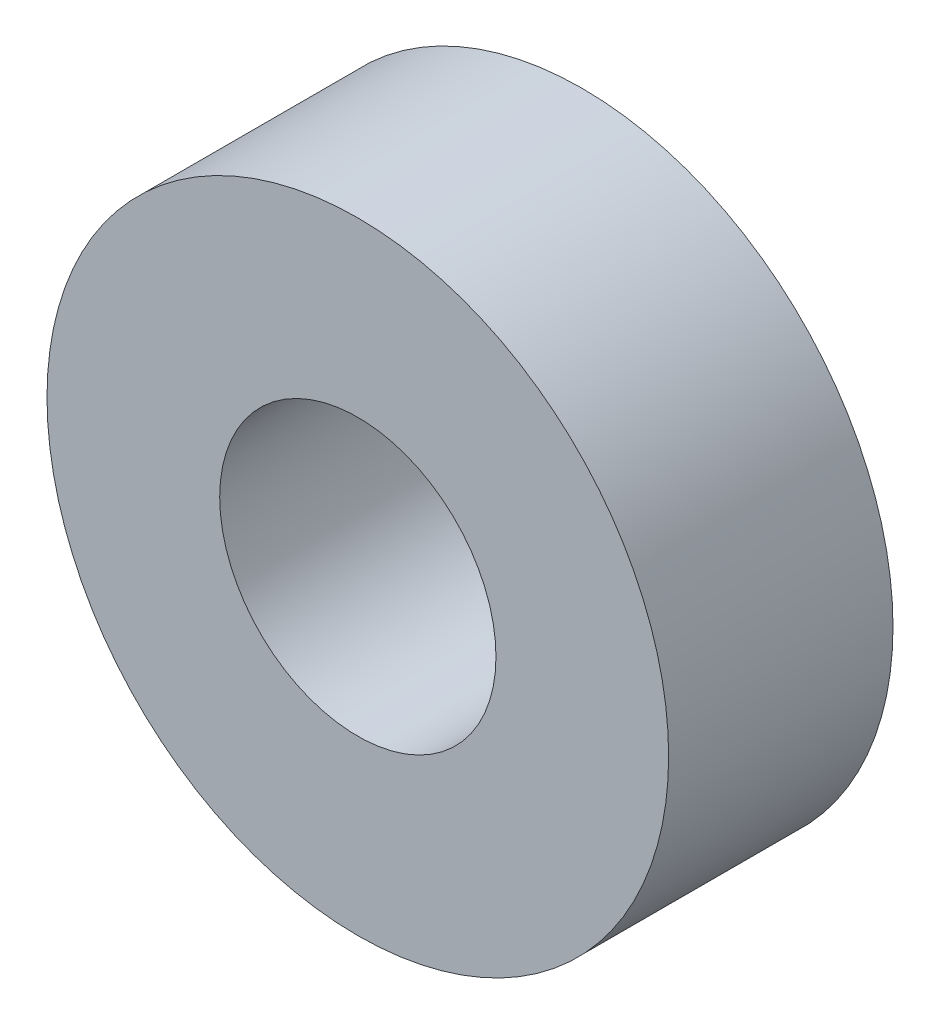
SolidWorks part; units mm, degrees
ref_plane "Front Plane" through (0, 0, 0) normal (0, 0, 1) x (1, 0, 0)
ref_plane "Top Plane" through (0, 0, 0) normal (0, 1, 0) x (1, 0, 0)
ref_plane "Right Plane" through (0, 0, 0) normal (1, 0, 0) x (0, 0, -1)
sketch "Sketch1" plane through (0, 0, 0) normal (0, 0, 1) x (1, 0, 0)
  circle A0 centre (0, 0) radius 6.35
  circle A1 centre (0, 0) radius 14.2875
  dimension "D1" = 12.7
  dimension "D2" = 28.575
extrude "Extrude1" add sketch "Sketch1" along normal blind 10.3124
